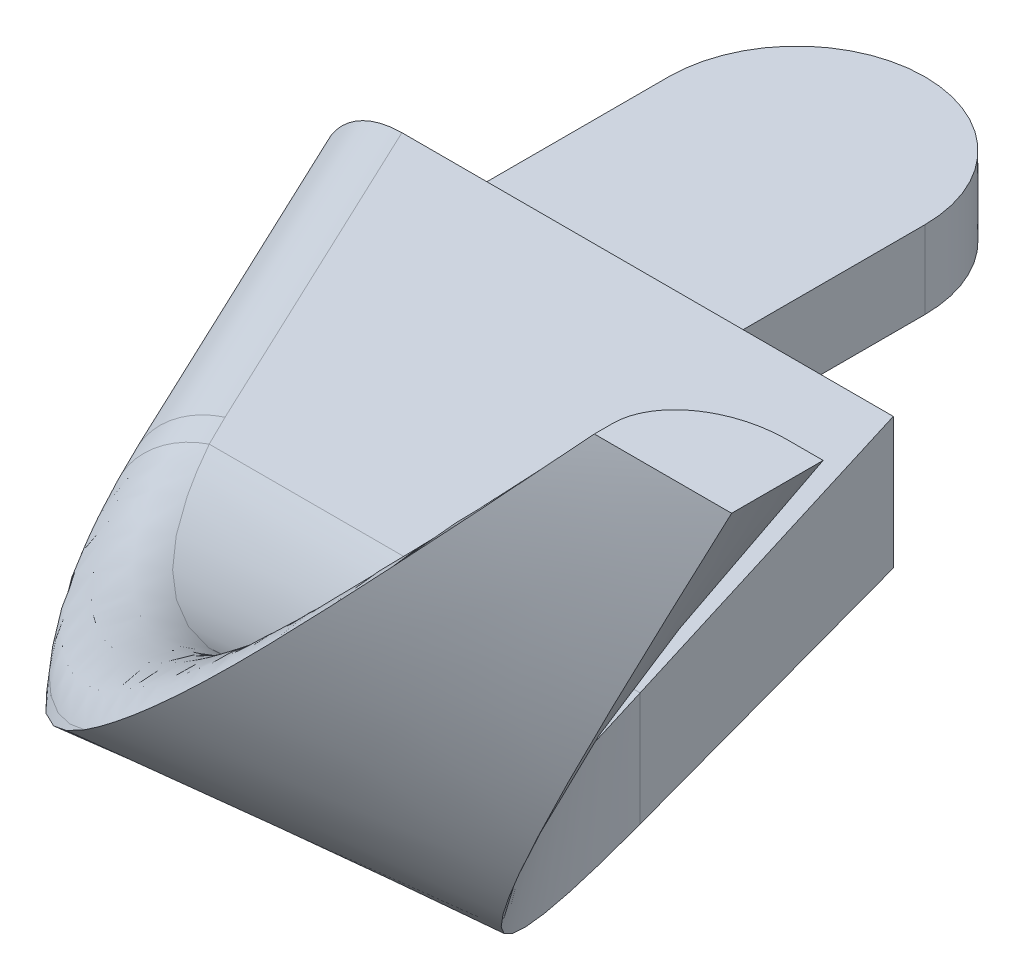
SolidWorks part; units mm, degrees
other "<11-Winglet droit>-<Congé2>"
ref_plane "Plan de face" through (0, 0, 0) normal (0, 0, 1) x (1, 0, 0)
ref_plane "Plan de dessus" through (0, 0, 0) normal (0, 1, 0) x (1, 0, 0)
ref_plane "Plan de droite" through (0, 0, 0) normal (1, 0, 0) x (0, 0, -1)
sketch "Esquisse1-11-Winglet droit_Symétrique" plane through (0, 5.0584, 0) normal (0, -1, 0) x (-1, 0, 0)
  line L0 (-70.5168, -107) -> (-70.5168, -97)
  line L1 (-70.5168, -97) -> (-54.8814, -97)
  line L2 (-54.8814, -97) -> (-54.8814, -107)
  line L3 (-54.8814, -107) -> (-70.5168, -107)
sketch "Esquisse2-11-Winglet droit_Symétrique" plane through (0, 0, 107) normal (0, 0, -1) x (-1, 0, 0)
  line L6 (-59.6, 4.8649) -> (-59.6, 8.2)
  line L7 (-59.6, 8.2) -> (-73.6, 8.2)
  line L8 (-73.6, 8.2) -> (-73.6, 5.0957)
  arc A1 (-59.6, 4.8649) -> (-73.6, 5.0957) centre (-87.0026, -1232.7717) ccw
sketch "Esquisse3-11-Winglet droit_Symétrique" plane through (0, 26.2, 0) normal (0, -1, 0) x (1, 0, 0)
  line L1 (84.85, 119.5) -> (88.6, 119.5)
  line L2 (84.85, 119.5) -> (84.85, 117)
  line L3 (84.85, 117) -> (88.6, 117)
  line L4 (88.6, 119.5) -> (88.6, 117)
  dimension "D1" = 2.5
  dimension "D2" = 3.75
sketch "Esquisse4-11-Winglet droit_Symétrique" plane through (0, 0, 97) normal (0, 0, 1) x (1, 0, 0)
  line L0 (64.8814, 4.5408) -> (64.8814, 6.6677)
  line L1 (64.8814, 6.6677) -> (57.8814, 6.6677)
  line L2 (57.8814, 6.6677) -> (57.8814, 4.4177)
  spline S1 degree 3 poles (57.8814, 4.4177) (60.2146, 4.4653) (62.5479, 4.5064) (64.8814, 4.5408) knots 0.191889 0.191889 0.191889 0.191889 0.639599 0.639599 0.639599 0.639599
  dimension "D2" = 7
  dimension "D3" = 2.25
mirrored part "11-Winglet droit_Symétrique"
